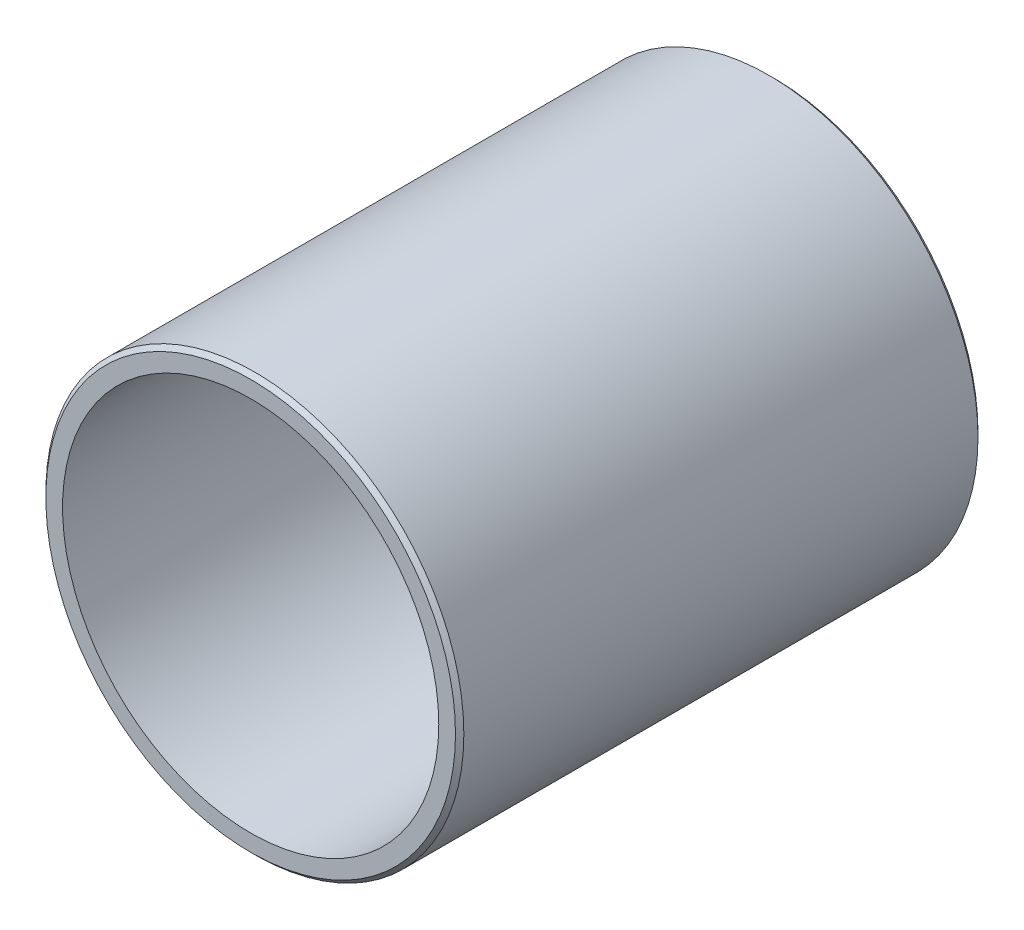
SolidWorks part; units mm, degrees
ref_plane "face" through (0, 0, 0) normal (0, 0, 1) x (1, 0, 0)
ref_plane "dessus" through (0, 0, 0) normal (0, 1, 0) x (1, 0, 0)
ref_plane "profil" through (0, 0, 0) normal (1, 0, 0) x (0, 0, -1)
sketch "Esquisse1" plane through (0, 0, 0) normal (0, 0, 1) x (1, 0, 0)
  circle A0 centre (0, 0) radius 10
  circle A1 centre (0, 0) radius 9
  dimension "D1" = 18
  dimension "D2" = 20
extrude "Base-Extrusion" add sketch "Esquisse1" against normal blind 25
chamfer "Chanfrein1" distance 0.2 angle 45 2 edges at (10, 0, 0) (10, 0, -25)
sketch "Esq_WRNL_Compact001" plane through (0, 0, 0) normal (0, 0, 1) x (1, 0, 0)
  line L0 (-11, -11) -> (-11, 11)
  line L1 (11, -11) -> (11, 11)
  line L2 (-11, -11) -> (11, -11)
  line L3 (-11, 11) -> (11, 11)
